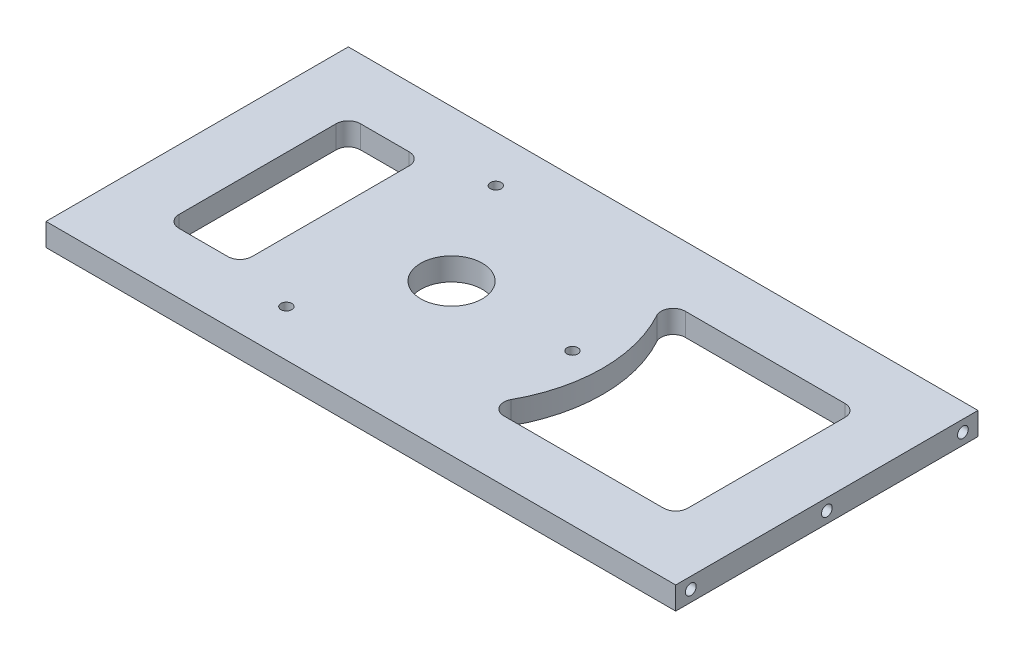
SolidWorks part; units mm, degrees
ref_plane "Front Plane" through (0, 0, 0) normal (0, 0, 1) x (1, 0, 0)
ref_plane "Top Plane" through (0, 0, 0) normal (0, 1, 0) x (1, 0, 0)
ref_plane "Right Plane" through (0, 0, 0) normal (1, 0, 0) x (0, 0, -1)
sketch "Sketch1" plane through (0, 0, 0) normal (0, 1, 0) x (1, 0, 0)
  line L1 (-66.1353, -31.75) -> (66.1352, -31.75)
  line L2 (-66.1353, -31.75) -> (-66.1353, 31.75)
  line L3 (-66.1353, 31.75) -> (66.1352, 31.75)
  line L4 (66.1352, -31.75) -> (66.1352, 31.75)
  line L5 (-66.1353, -31.75) -> (66.1352, 31.75) construction
  line L6 (-66.1353, 31.75) -> (66.1352, -31.75) construction
  point P0 (0, 0)
  dimension "D1" = 132.2705
  dimension "D2" = 63.5
extrude "Boss-Extrude1" add sketch "Sketch1" along normal blind 4.7625
sketch "Sketch2" plane through (-66.1353, 0, 0) normal (-1, 0, 0) x (0, 0, 1)
  line L0 (0, 4.7625) -> (0, 0) construction
  line L1 (-31.75, 4.7625) -> (31.75, 4.7625) construction
  line L2 (-31.75, 4.7625) -> (-31.75, 0) construction
  line L3 (-31.75, 2.3813) -> (31.75, 2.3813) construction
  line L4 (31.75, 4.7625) -> (31.75, 0) construction
  circle A0 centre (-28.575, 2.3813) radius 1.1303
  circle A1 centre (28.575, 2.3813) radius 1.1303
  circle A2 centre (0, 2.3813) radius 1.1303
  dimension "D1" = 2.2606
  dimension "D2" = 3.175
extrude "Cut-Extrude1" cut sketch "Sketch2" against normal blind 10.16
mirror "Mirror1" about plane through (0, 0, 0) normal (1, 0, 0) of "Cut-Extrude1"
sketch "Sketch3" plane through (0, 4.7625, 0) normal (0, 1, 0) x (1, 0, 0)
  circle A0 centre (-12.7, 0) radius 6.477
  dimension "D1" = 12.954
  dimension "D2" = 12.7
extrude "Cut-Extrude2" cut sketch "Sketch3" against normal through all
sketch "Sketch4" plane through (0, 4.7625, 0) normal (0, 1, 0) x (1, 0, 0)
  line L0 (-12.7, 0) -> (-25.4, 21.997) construction
  circle A0 centre (-12.7, 0) radius 25.4 construction
  circle A1 centre (-25.4, 21.997) radius 1.143
  circle A2 centre (12.7, 0) radius 1.143
  circle A3 centre (-25.4, -21.997) radius 1.143
  dimension "D1" = 50.8
  dimension "D2" = 2.286
  dimension "D4" = 25.4
  dimension "D3" = 3
extrude "Cut-Extrude3" cut sketch "Sketch4" against normal through all
sketch "Sketch5" plane through (0, 4.7625, 0) normal (0, 1, 0) x (1, 0, 0)
  line L0 (-66.1353, 31.75) -> (-66.1353, -31.75) construction
  line L3 (-66.1353, 31.75) -> (-66.1353, -31.75) construction
  line L4 (-66.1353, -31.75) -> (65.3415, -31.75) construction
  line L6 (53.4352, 19.05) -> (12.7, 19.05)
  line L7 (-53.4353, 19.05) -> (-53.4352, -19.05)
  line L8 (-53.4352, -19.05) -> (-38.1, -19.05)
  line L9 (-38.1, 19.05) -> (-38.1, -19.05)
  line L10 (65.3415, 31.75) -> (-66.1353, 31.75) construction
  line L11 (-38.1, 19.05) -> (-53.4353, 19.05)
  line L12 (65.3415, 19.05) -> (-53.4353, 19.05) construction
  line L13 (12.7, -19.05) -> (53.4352, -19.05)
  line L14 (-53.4352, -19.05) -> (65.3415, -19.05) construction
  line L16 (53.4352, -31.75) -> (53.4352, 31.75)
  line L17 (53.4352, -19.05) -> (53.4352, 19.05)
  arc A1 (12.7, -19.05) -> (12.7, 19.05) centre (-12.7, 0) ccw
  dimension "D4" = 31.75
  dimension "D3" = 25.4
  dimension "D1" = 12.7
  dimension "D2" = 12.7
extrude "Cut-Extrude4" cut sketch "Sketch5" against normal through all
fillet "Fillet1" radius 2.54 8 edges at (-38.1, 2.3813, 19.05) (53.4352, 2.3813, 19.05) (-53.4352, 2.3813, 19.05) (12.7, 2.3813, 19.05) (-38.1, 2.3813, -19.05) (53.4352, 2.3813, -19.05) (12.7, 2.3813, -19.05) (-53.4353, 2.3813, -19.05)
